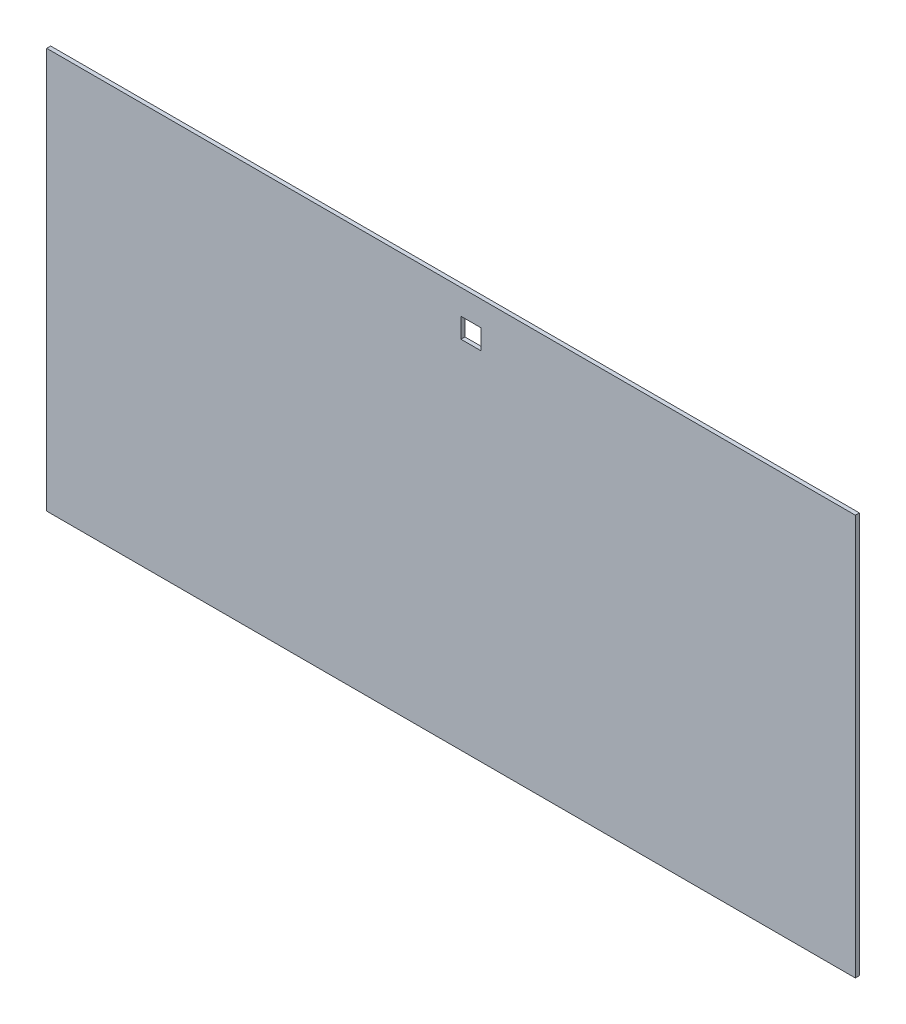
SolidWorks part; units mm, degrees
ref_plane "Ebene vorne" through (0, 0, 0) normal (0, 0, 1) x (1, 0, 0)
ref_plane "Ebene oben" through (0, 0, 0) normal (0, 1, 0) x (1, 0, 0)
ref_plane "Ebene rechts" through (0, 0, 0) normal (1, 0, 0) x (0, 0, -1)
sketch "Skizze1" plane through (0, 0, 0) normal (0, 0, 1) x (1, 0, 0)
  line L1 (-406, -201.25) -> (406, -201.25)
  line L2 (-406, -201.25) -> (-406, 201.25)
  line L3 (-406, 201.25) -> (406, 201.25)
  line L4 (406, -201.25) -> (406, 201.25)
  line L5 (-406, -201.25) -> (406, 201.25) construction
  line L6 (-406, 201.25) -> (406, -201.25) construction
  point P0 (0, 0)
  dimension "D1" = 812
  dimension "D2" = 402.5
extrude "Aufsatz-Linear austragen1" add sketch "Skizze1" along normal blind 4
sketch "Skizze2" plane through (0, 0, 4) normal (0, 0, 1) x (1, 0, 0)
  line L0 (406, 201.25) -> (-406, 201.25) construction
  line L1 (10, 176.25) -> (30, 176.25)
  line L2 (10, 176.25) -> (10, 156.25)
  line L3 (10, 156.25) -> (30, 156.25)
  line L4 (30, 176.25) -> (30, 156.25)
  dimension "D1" = 10
  dimension "D2" = 25
  dimension "D3" = 45
  dimension "D4" = 20
extrude "Schnitt-Linear austragen1" cut sketch "Skizze2" against normal through all
